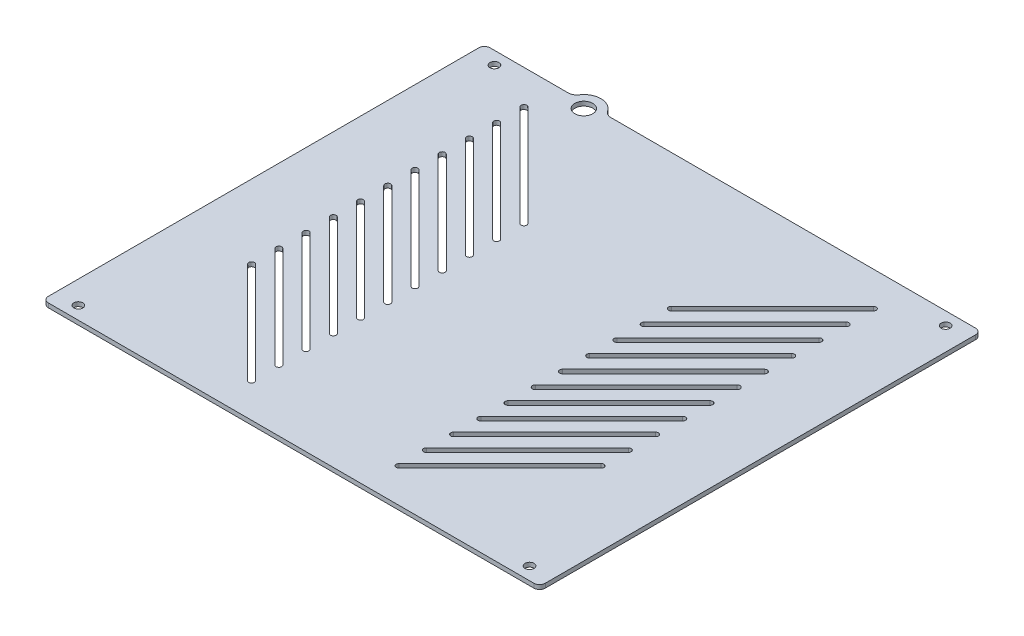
SolidWorks part; units mm, degrees
ref_plane "Front Plane" through (0, 0, 0) normal (0, 0, 1) x (1, 0, 0)
ref_plane "Top Plane" through (0, 0, 0) normal (0, 1, 0) x (1, 0, 0)
ref_plane "Right Plane" through (0, 0, 0) normal (1, 0, 0) x (0, 0, -1)
sketch "Sketch1" plane through (0, 0, 0) normal (0, 1, 0) x (1, 0, 0)
  line L1 (87, -77.35) -> (-87, -77.35)
  line L2 (87, -77.35) -> (87, 77.35)
  line L3 (87, 77.35) -> (-87, 77.35)
  line L4 (-87, -77.35) -> (-87, 77.35)
  line L5 (87, -77.35) -> (-87, 77.35) construction
  line L6 (87, 77.35) -> (-87, -77.35) construction
  line L7 (79, -72.85) -> (-79, -72.85) construction
  line L8 (79, -72.85) -> (79, 72.85) construction
  line L9 (79, 72.85) -> (-79, 72.85) construction
  line L10 (-79, -72.85) -> (-79, 72.85) construction
  line L11 (79, -72.85) -> (-79, 72.85) construction
  line L12 (79, 72.85) -> (-79, -72.85) construction
  circle A0 centre (-79, 72.85) radius 1.575
  circle A1 centre (79, 72.85) radius 1.575
  circle A2 centre (79, -72.85) radius 1.575
  circle A3 centre (-79, -72.85) radius 1.575
  point P0 (0, 0)
  point P5 (0, 0)
  dimension "D5" = 3.15
  dimension "D1" = 154.7
  dimension "D2" = 174
  dimension "D3" = 145.7
  dimension "D4" = 158
base flange "Base-Flange1" sketch "Sketch1" thickness 1.5 reverse thickness direction no parameters "D1"=1.65
fillet "Fillet1" radius 2 4 edges at (-87, -0.75, -77.35) (87, -0.75, -77.35) (-87, -0.75, 77.35) (87, -0.75, 77.35)
sketch "Sketch6" plane through (0, 0, 0) normal (0, 1, 0) x (1, 0, 0)
  line L0 (0, -77.35) -> (0, 77.35) construction
  line L1 (-85, -77.35) -> (85, -77.35) construction
  line L2 (85, 77.35) -> (-85, 77.35) construction
  line L3 (25.8223, -65.35) -> (61.1777, -29.9947) construction
  line L4 (0, -77.35) -> (87, -77.35) construction
  line L5 (87, -77.35) -> (87, 0) construction
  line L6 (87, -75.35) -> (87, 75.35) construction
  line L7 (26.5294, -66.0571) -> (61.8848, -30.7018)
  line L8 (25.1152, -64.6429) -> (60.4706, -29.2876)
  line L9 (26.5294, -56.5226) -> (61.8848, -21.1673)
  line L10 (25.1152, -55.1084) -> (60.4706, -19.7531)
  line L11 (25.8223, -55.8155) -> (61.1777, -20.4602) construction
  line L12 (26.5294, -46.9882) -> (61.8848, -11.6328)
  line L13 (25.1152, -45.574) -> (60.4706, -10.2186)
  line L14 (25.8223, -46.2811) -> (61.1777, -10.9257) construction
  line L15 (26.5294, -37.4537) -> (61.8848, -2.0984)
  line L16 (25.1152, -36.0395) -> (60.4706, -0.6842)
  line L17 (25.8223, -36.7466) -> (61.1777, -1.3913) construction
  line L18 (26.5294, -27.9192) -> (61.8848, 7.4361)
  line L19 (25.1152, -26.505) -> (60.4706, 8.8503)
  line L20 (25.8223, -27.2121) -> (61.1777, 8.1432) construction
  line L21 (26.5294, -18.3848) -> (61.8848, 16.9706)
  line L22 (25.1152, -16.9706) -> (60.4706, 18.3848)
  line L23 (25.8223, -17.6777) -> (61.1777, 17.6777) construction
  line L24 (26.5294, -8.8503) -> (61.8848, 26.505)
  line L25 (25.1152, -7.4361) -> (60.4706, 27.9192)
  line L26 (25.8223, -8.1432) -> (61.1777, 27.2121) construction
  line L27 (26.5294, 0.6842) -> (61.8848, 36.0395)
  line L28 (25.1152, 2.0984) -> (60.4706, 37.4537)
  line L29 (25.8223, 1.3913) -> (61.1777, 36.7466) construction
  line L30 (26.5294, 10.2186) -> (61.8848, 45.574)
  line L31 (25.1152, 11.6328) -> (60.4706, 46.9882)
  line L32 (25.8223, 10.9257) -> (61.1777, 46.2811) construction
  line L33 (26.5294, 19.7531) -> (61.8848, 55.1084)
  line L34 (25.1152, 21.1673) -> (60.4706, 56.5226)
  line L35 (25.8223, 20.4602) -> (61.1777, 55.8155) construction
  line L36 (26.5294, 29.2876) -> (61.8848, 64.6429)
  line L37 (25.1152, 30.7018) -> (60.4706, 66.0571)
  line L38 (25.8223, 29.9947) -> (61.1777, 65.35) construction
  line L39 (-25.8223, 29.9947) -> (-61.1777, 65.35) construction
  line L40 (-25.8223, 20.4602) -> (-61.1777, 55.8155) construction
  line L41 (-25.8223, 10.9257) -> (-61.1777, 46.2811) construction
  line L42 (-25.8223, 1.3913) -> (-61.1777, 36.7466) construction
  line L43 (-25.8223, -8.1432) -> (-61.1777, 27.2121) construction
  line L44 (-25.8223, -17.6777) -> (-61.1777, 17.6777) construction
  line L45 (-25.8223, -27.2121) -> (-61.1777, 8.1432) construction
  line L46 (-25.8223, -36.7466) -> (-61.1777, -1.3913) construction
  line L47 (-25.8223, -46.2811) -> (-61.1777, -10.9257) construction
  line L48 (-25.8223, -55.8155) -> (-61.1777, -20.4602) construction
  line L49 (-87, -77.35) -> (-87, 0) construction
  line L50 (-25.8223, -65.35) -> (-61.1777, -29.9947) construction
  line L51 (-25.1152, 30.7018) -> (-60.4706, 66.0571)
  line L52 (-26.5294, 29.2876) -> (-61.8848, 64.6429)
  line L53 (-25.1152, 21.1673) -> (-60.4706, 56.5226)
  line L54 (-26.5294, 19.7531) -> (-61.8848, 55.1084)
  line L55 (-25.1152, 11.6328) -> (-60.4706, 46.9882)
  line L56 (-26.5294, 10.2186) -> (-61.8848, 45.574)
  line L57 (-25.1152, 2.0984) -> (-60.4706, 37.4537)
  line L58 (-26.5294, 0.6842) -> (-61.8848, 36.0395)
  line L59 (-25.1152, -7.4361) -> (-60.4706, 27.9192)
  line L60 (-26.5294, -8.8503) -> (-61.8848, 26.505)
  line L61 (-25.1152, -16.9706) -> (-60.4706, 18.3848)
  line L62 (-26.5294, -18.3848) -> (-61.8848, 16.9706)
  line L63 (-25.1152, -26.505) -> (-60.4706, 8.8503)
  line L64 (-26.5294, -27.9192) -> (-61.8848, 7.4361)
  line L65 (-25.1152, -36.0395) -> (-60.4706, -0.6842)
  line L66 (-26.5294, -37.4537) -> (-61.8848, -2.0984)
  line L67 (-25.1152, -45.574) -> (-60.4706, -10.2186)
  line L68 (-26.5294, -46.9882) -> (-61.8848, -11.6328)
  line L69 (-25.1152, -55.1084) -> (-60.4706, -19.7531)
  line L70 (-26.5294, -56.5226) -> (-61.8848, -21.1673)
  line L71 (-25.1152, -64.6429) -> (-60.4706, -29.2876)
  line L72 (-26.5294, -66.0571) -> (-61.8848, -30.7018)
  arc A0 (26.5294, -66.0571) -> (25.1152, -64.6429) centre (25.8223, -65.35) cw
  arc A1 (61.8848, -30.7018) -> (60.4706, -29.2876) centre (61.1777, -29.9947) ccw
  arc A2 (26.5294, -56.5226) -> (25.1152, -55.1084) centre (25.8223, -55.8155) cw
  arc A3 (61.8848, -21.1673) -> (60.4706, -19.7531) centre (61.1777, -20.4602) ccw
  arc A4 (26.5294, -46.9882) -> (25.1152, -45.574) centre (25.8223, -46.2811) cw
  arc A5 (61.8848, -11.6328) -> (60.4706, -10.2186) centre (61.1777, -10.9257) ccw
  arc A6 (26.5294, -37.4537) -> (25.1152, -36.0395) centre (25.8223, -36.7466) cw
  arc A7 (61.8848, -2.0984) -> (60.4706, -0.6842) centre (61.1777, -1.3913) ccw
  arc A8 (26.5294, -27.9192) -> (25.1152, -26.505) centre (25.8223, -27.2121) cw
  arc A9 (61.8848, 7.4361) -> (60.4706, 8.8503) centre (61.1777, 8.1432) ccw
  arc A10 (26.5294, -18.3848) -> (25.1152, -16.9706) centre (25.8223, -17.6777) cw
  arc A11 (61.8848, 16.9706) -> (60.4706, 18.3848) centre (61.1777, 17.6777) ccw
  arc A12 (26.5294, -8.8503) -> (25.1152, -7.4361) centre (25.8223, -8.1432) cw
  arc A13 (61.8848, 26.505) -> (60.4706, 27.9192) centre (61.1777, 27.2121) ccw
  arc A14 (26.5294, 0.6842) -> (25.1152, 2.0984) centre (25.8223, 1.3913) cw
  arc A15 (61.8848, 36.0395) -> (60.4706, 37.4537) centre (61.1777, 36.7466) ccw
  arc A16 (26.5294, 10.2186) -> (25.1152, 11.6328) centre (25.8223, 10.9257) cw
  arc A17 (61.8848, 45.574) -> (60.4706, 46.9882) centre (61.1777, 46.2811) ccw
  arc A18 (26.5294, 19.7531) -> (25.1152, 21.1673) centre (25.8223, 20.4602) cw
  arc A19 (61.8848, 55.1084) -> (60.4706, 56.5226) centre (61.1777, 55.8155) ccw
  arc A20 (26.5294, 29.2876) -> (25.1152, 30.7018) centre (25.8223, 29.9947) cw
  arc A21 (61.8848, 64.6429) -> (60.4706, 66.0571) centre (61.1777, 65.35) ccw
  arc A22 (-61.8848, 64.6429) -> (-60.4706, 66.0571) centre (-61.1777, 65.35) cw
  arc A23 (-26.5294, 29.2876) -> (-25.1152, 30.7018) centre (-25.8223, 29.9947) ccw
  arc A24 (-61.8848, 55.1084) -> (-60.4706, 56.5226) centre (-61.1777, 55.8155) cw
  arc A25 (-26.5294, 19.7531) -> (-25.1152, 21.1673) centre (-25.8223, 20.4602) ccw
  arc A26 (-61.8848, 45.574) -> (-60.4706, 46.9882) centre (-61.1777, 46.2811) cw
  arc A27 (-26.5294, 10.2186) -> (-25.1152, 11.6328) centre (-25.8223, 10.9257) ccw
  arc A28 (-61.8848, 36.0395) -> (-60.4706, 37.4537) centre (-61.1777, 36.7466) cw
  arc A29 (-26.5294, 0.6842) -> (-25.1152, 2.0984) centre (-25.8223, 1.3913) ccw
  arc A30 (-61.8848, 26.505) -> (-60.4706, 27.9192) centre (-61.1777, 27.2121) cw
  arc A31 (-26.5294, -8.8503) -> (-25.1152, -7.4361) centre (-25.8223, -8.1432) ccw
  arc A32 (-61.8848, 16.9706) -> (-60.4706, 18.3848) centre (-61.1777, 17.6777) cw
  arc A33 (-26.5294, -18.3848) -> (-25.1152, -16.9706) centre (-25.8223, -17.6777) ccw
  arc A34 (-61.8848, 7.4361) -> (-60.4706, 8.8503) centre (-61.1777, 8.1432) cw
  arc A35 (-26.5294, -27.9192) -> (-25.1152, -26.505) centre (-25.8223, -27.2121) ccw
  arc A36 (-61.8848, -2.0984) -> (-60.4706, -0.6842) centre (-61.1777, -1.3913) cw
  arc A37 (-26.5294, -37.4537) -> (-25.1152, -36.0395) centre (-25.8223, -36.7466) ccw
  arc A38 (-61.8848, -11.6328) -> (-60.4706, -10.2186) centre (-61.1777, -10.9257) cw
  arc A39 (-26.5294, -46.9882) -> (-25.1152, -45.574) centre (-25.8223, -46.2811) ccw
  arc A40 (-61.8848, -21.1673) -> (-60.4706, -19.7531) centre (-61.1777, -20.4602) cw
  arc A41 (-26.5294, -56.5226) -> (-25.1152, -55.1084) centre (-25.8223, -55.8155) ccw
  arc A42 (-61.8848, -30.7018) -> (-60.4706, -29.2876) centre (-61.1777, -29.9947) cw
  arc A43 (-26.5294, -66.0571) -> (-25.1152, -64.6429) centre (-25.8223, -65.35) ccw
  point P12 (43.5, -77.35)
  point P13 (43.5, -47.6723)
  dimension "D1" = 45
  dimension "D2" = 50
  dimension "D3" = 12
  dimension "D7" = 12
  dimension "D4" = 1
  dimension "D5" = 1
  dimension "D6" = 11
extrude "Cut-Extrude1" cut sketch "Sketch6" against normal through all
sketch "Sketch7" plane through (0, 0, 0) normal (0, 1, 0) x (1, 0, 0)
  circle A0 centre (-50.195, 75.35) radius 6 construction
  circle A1 centre (-50.195, 75.35) radius 6
base flange "Tab1" sketch "Sketch7" thickness 1.5 reverse thickness direction no parameters "D1"=1.65
sketch "Sketch10" plane through (0, 0, 0) normal (0, 1, 0) x (1, 0, 0)
  circle A0 centre (-50.195, 75.35) radius 3 construction
  circle A1 centre (-50.195, 75.35) radius 3 construction
  circle A2 centre (-50.195, 75.35) radius 3.15
  dimension "D1" = 6.3
extrude "Cut-Extrude2" cut sketch "Sketch10" against normal through all
fillet "Fillet2" radius 3 2 edges at (-55.8519, -0.75, -77.35) (-44.5381, -0.75, -77.35)
sketch "Bend-Lines1" [suppressed] plane through (0, 0, 0) normal (0, 1, 0) x (1, 0, 0)
sketch "Bounding-Box1" [suppressed] plane through (0, 0, 0) normal (0, 1, 0) x (1, 0, 0)
sheet metal parameters "Sheet-Metal1" thickness 1.5 parameters "D1"=1.65
flat pattern "Flat-Pattern1"
sketch "Bend-Lines2" plane through (0, 0, 0) normal (0, 1, 0) x (1, 0, 0)
sketch3d "Bounding-Box2" [suppressed]
  line L0 (-77.5, -67.7499, 0) -> (77.5, -67.75, 0) construction
  line L1 (-77.4999, 67.75, 0) -> (77.5001, 67.7499, 0) construction
  line L2 (-77.5, -67.7499, 0) -> (-77.4999, 67.75, 0) construction
  line L3 (77.5, -67.75, 0) -> (77.5001, 67.7499, 0) construction
sheet metal parameters "Sheet-Metal2" thickness 1.5 parameters "D1"=1.65
flat pattern "Flat-Pattern1"
sketch "Bend-Lines2" plane through (0, 0, 0) normal (0, 1, 0) x (1, 0, 0)
sketch3d "Bounding-Box2" [suppressed]
  line L0 (-87, -77.3499, 0) -> (87, -77.35, 0) construction
  line L1 (-86.9999, 77.35, 0) -> (87.0001, 77.3499, 0) construction
  line L2 (-87, -77.3499, 0) -> (-86.9999, 77.35, 0) construction
  line L3 (87, -77.35, 0) -> (87.0001, 77.3499, 0) construction
sheet metal parameters "Sheet-Metal3" thickness 1.5 parameters "D1"=1.65
flat pattern "Flat-Pattern3"
sketch "Bend-Lines3" plane through (0, 0, 0) normal (0, 1, 0) x (1, 0, 0)
sketch3d "Bounding-Box3" [suppressed]
  line L0 (-87, -77.35, 0) -> (87, -77.35, 0) construction
  line L1 (-87, 81.35, 0) -> (87, 81.35, 0) construction
  line L2 (-87, -77.35, 0) -> (-87, 81.35, 0) construction
  line L3 (87, -77.35, 0) -> (87, 81.35, 0) construction
sheet metal parameters "Sheet-Metal4" thickness 1.5 parameters "D1"=1.65
flat pattern "Flat-Pattern3"
sketch "Bend-Lines3" plane through (0, 0, 0) normal (0, 1, 0) x (1, 0, 0)
sketch3d "Bounding-Box3" [suppressed]
  line L0 (-87, -77.35, 0) -> (87, -77.35, 0) construction
  line L1 (-87, 81.35, 0) -> (87, 81.35, 0) construction
  line L2 (-87, -77.35, 0) -> (-87, 81.35, 0) construction
  line L3 (87, -77.35, 0) -> (87, 81.35, 0) construction
